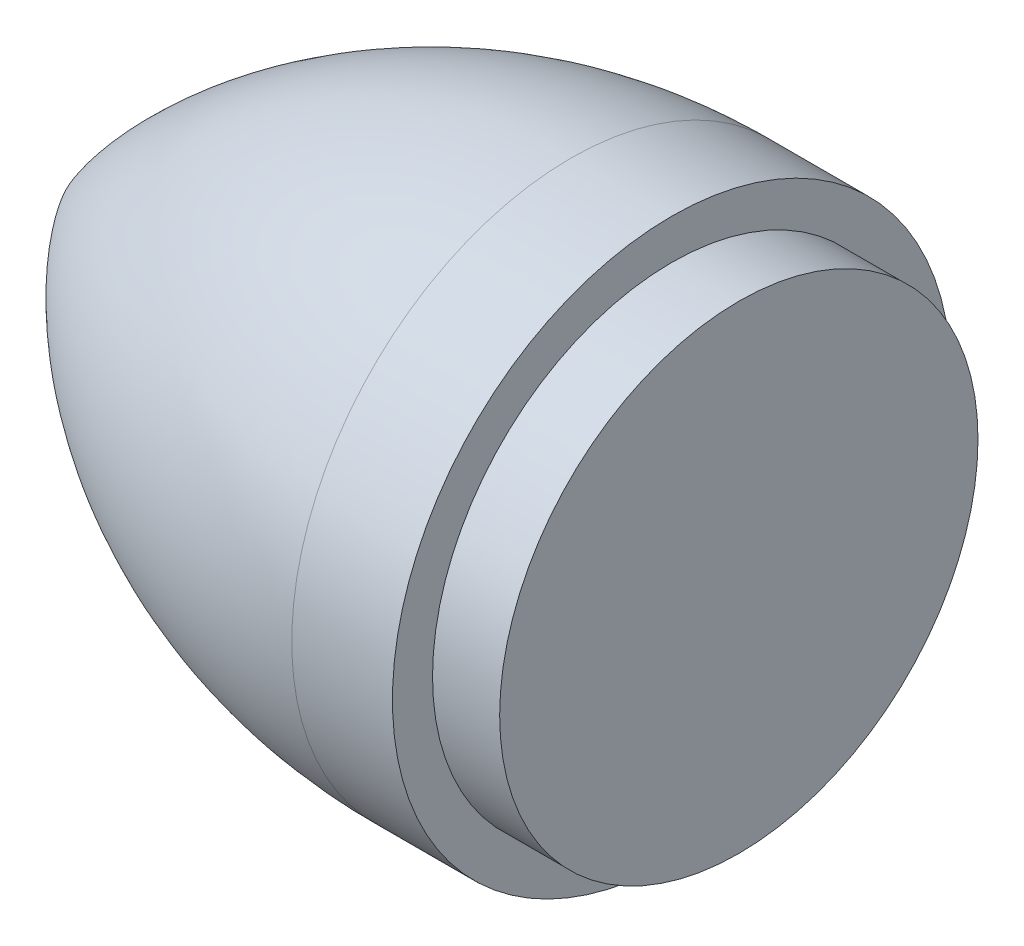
SolidWorks part; units mm, degrees
ref_plane "Front Plane" through (0, 0, 0) normal (0, 0, 1) x (1, 0, 0)
ref_plane "Top Plane" through (0, 0, 0) normal (0, 1, 0) x (1, 0, 0)
ref_plane "Right Plane" through (0, 0, 0) normal (1, 0, 0) x (0, 0, -1)
sketch "Sketch1" plane through (0, 0, 0) normal (0, 0, 1) x (1, 0, 0)
  line L0 (0, 0) -> (-200, 0) construction
  line L1 (0, 71.25) -> (0, 0)
  line L2 (0, 71.25) -> (-20, 71.25)
  line L3 (-20, 71.25) -> (-20, 83.185)
  line L4 (-20, 83.185) -> (-50, 83.185)
  line L5 (0, 0) -> (-200, 0)
  arc A0 (-50, 83.185) -> (-200, 0) centre (-50, -93.6482) ccw
  point P8 (0, 0)
  dimension "D1" = 30
  dimension "D2" = 83.185
  dimension "D3" = 20
  dimension "D4" = 150
  dimension "D5" = 71.25
revolve "Revolve4" add sketch "Sketch1" angle 360 about L0
